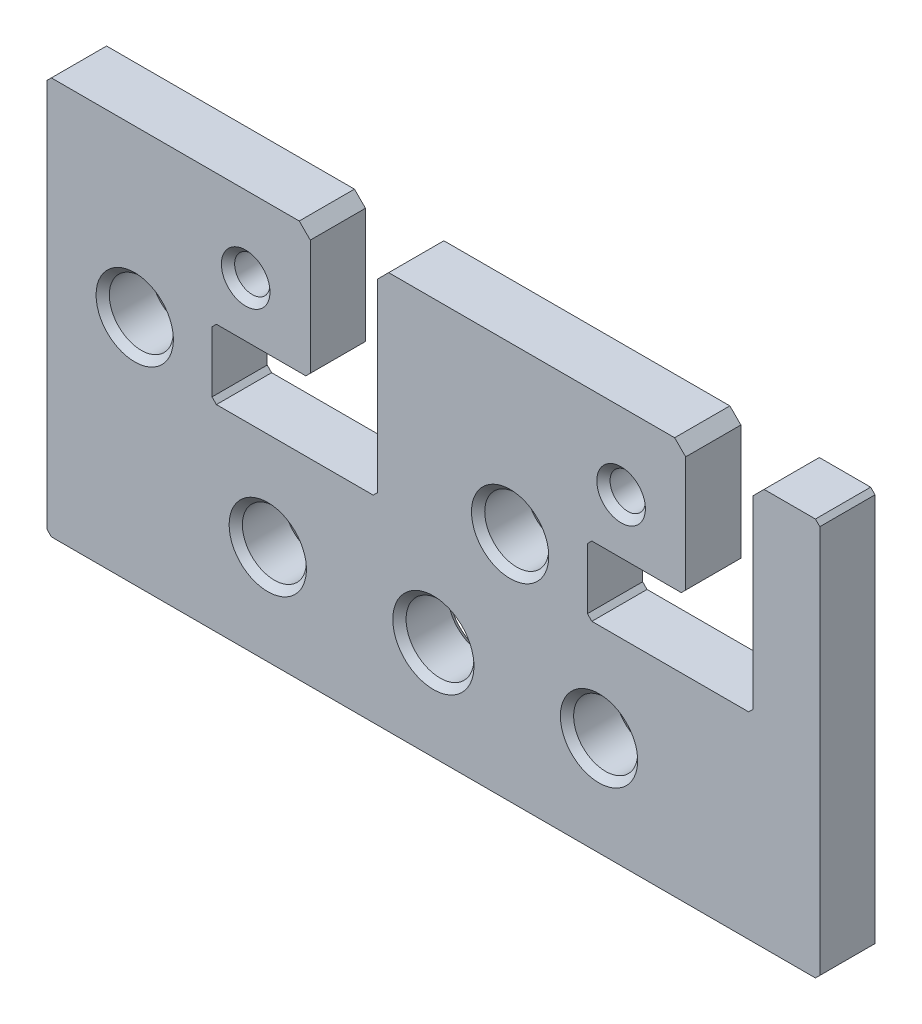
SolidWorks part; units mm, degrees
ref_plane "前基準面" through (0, 0, 0) normal (0, 0, 1) x (1, 0, 0)
ref_plane "上基準面" through (0, 0, 0) normal (0, 1, 0) x (1, 0, 0)
ref_plane "右基準面" through (0, 0, 0) normal (1, 0, 0) x (0, 0, -1)
sketch "草圖1" plane through (0, 0, 0) normal (0, 0, 1) x (1, 0, 0)
  line L0 (-14.0981, -2.6222) -> (55.9019, -2.6222)
  line L1 (55.9019, -2.6222) -> (55.9019, 33.3778)
  line L2 (-14.0981, -2.6222) -> (-14.0981, 33.3778)
  line L3 (-14.0981, 33.3778) -> (9.7519, 33.3778)
  line L4 (9.7519, 33.3778) -> (9.7519, 21.5278)
  line L5 (9.7519, 21.5278) -> (0.8519, 21.5278)
  line L6 (0.8519, 21.5278) -> (0.8519, 15.2278)
  line L7 (0.8519, 15.2278) -> (15.8519, 15.2278)
  line L8 (15.8519, 15.2278) -> (15.8519, 33.3778)
  line L9 (15.8519, 33.3778) -> (43.7519, 33.3778)
  line L10 (43.7519, 33.3778) -> (43.7519, 21.5278)
  line L11 (43.7519, 21.5278) -> (34.8519, 21.5278)
  line L12 (34.8519, 21.5278) -> (34.8519, 15.2278)
  line L13 (34.8519, 15.2278) -> (49.8519, 15.2278)
  line L14 (49.8519, 15.2278) -> (49.8519, 33.3778)
  line L15 (49.8519, 33.3778) -> (55.9019, 33.3778)
  line L16 (-1006.2885, 18.3778) -> (48993.7115, 18.3778) construction
  circle A0 centre (20.9019, 6.3778) radius 3.075
  circle A1 centre (35.9019, 6.3778) radius 2.9
  circle A2 centre (5.9019, 6.3778) radius 2.9
  circle A3 centre (3.9019, 26.4778) radius 1.6
  circle A4 centre (37.9019, 26.4778) radius 1.6
  circle A5 centre (27.8519, 18.3778) radius 2.9
  circle A6 centre (-6.1481, 18.3778) radius 2.9
  point P19 (0.8519, 18.3778)
  point P33 (0, 0)
  point P34 (20.9019, -2.6222)
  dimension "D11" = 6.15
  dimension "D12" = 9
  dimension "D14" = 5.8
  dimension "D15" = 5.8
  dimension "D16" = 15
  dimension "D17" = 15
  dimension "D18" = 3.2
  dimension "D20" = 4.95
  dimension "D21" = 3.05
  dimension "D22" = 3.05
  dimension "D23" = 6.3
  dimension "D24" = 5.8
  dimension "D25" = 5.8
  dimension "D4" = 18
  dimension "D7" = 7
  dimension "D1" = 36
  dimension "D2" = 70
  dimension "D3" = 6.1
  dimension "D5" = 18
  dimension "D6" = 7
  dimension "D8" = 15
  dimension "D9" = 15
extrude "填料-伸長1" add sketch "草圖1" along normal blind 5
chamfer "導角2" distance 0.4 angle 45 6 edges at (43.7519, 21.5278, 2.5) (9.7519, 21.5278, 2.5) (-14.0981, -2.6222, 2.5) (55.9019, -2.6222, 2.5) (55.9019, 33.3778, 2.5) (-14.0981, 33.3778, 2.5)
chamfer "導角3" distance 1 angle 45 4 edges at (49.8519, 33.3778, 2.5) (43.7519, 33.3778, 2.5) (15.8519, 33.3778, 2.5) (9.7519, 33.3778, 2.5)
chamfer "導角5" distance 0.4 angle 45 6 edges at (49.8519, 15.2278, 2.5) (15.8519, 15.2278, 2.5) (34.8519, 15.2278, 2.5) (34.8519, 21.5278, 2.5) (0.8519, 15.2278, 2.5) (0.8519, 21.5278, 2.5)
sketch "草圖2" plane through (0, -2.6222, 0) normal (0, -1, 0) x (1, 0, 0)
  line L0 (-13.6981, 0) -> (55.5019, 0) construction
  line L1 (20.9019, -995) -> (20.9019, 49005) construction
  line L2 (-13.6981, 5) -> (55.5019, 5) construction
  circle A0 centre (-1.6981, 2.5) radius 1.4
  circle A1 centre (43.5019, 2.5) radius 1.4
  point P13 (20.9019, 5)
  dimension "D1" = 2.8
  dimension "D2" = 2.8
  dimension "D4" = 45.2
  dimension "D5" = 22.6
  dimension "D3" = 2.5
extrude "除料-伸長1" cut sketch "草圖2" against normal blind 10
chamfer "導角4" distance 0.6 angle 45 16 edges at (5.5019, 26.4778, 5) (39.5019, 26.4778, 0) (8.8019, 6.3778, 0) (23.9769, 6.3778, 0) (38.8019, 6.3778, 0) (43.5019, -2.6222, 1.1) (-1.6981, -2.6222, 1.1) (8.8019, 6.3778, 5) (38.8019, 6.3778, 5) (23.9769, 6.3778, 5) (39.5019, 26.4778, 5) (5.5019, 26.4778, 0) (30.7519, 18.3778, 0) (30.7519, 18.3778, 5) (-3.2481, 18.3778, 0) (-3.2481, 18.3778, 5)
thread "螺紋2" pitch 1 start angle 0, offset 0, length 2.8, pitch 1, diameter 6
ref_plane "平面3" through (38.9019, 6.4278, 0.6) normal (0, -1, 0) x (1, 0, 0)
sketch "螺紋輪廓3" plane through (38.9019, 6.4278, 0.6) normal (0, -1, 0) x (1, 0, 0)
  line L0 (0, 0) -> (0, 1) construction
  line L11 (0, 0) -> (0, 0.875)
  line L12 (0, 0.875) -> (-0.5413, 0.5625)
  line L13 (-0.5413, 0.5625) -> (-0.5413, 0.3125)
  line L15 (-0.5413, 0.3125) -> (0, 0)
  line L17 (-0.5413, 0.4375) -> (0, 0.4375) construction
  point P2 (0, 0)
  dimension "Pitch" = 1
  dimension "Profile_Angle" = 60
  dimension "Profile_Land" = 0.25
  dimension "Profile_Height" = 0.5413
thread "螺紋3" pitch 1 start angle 0, offset 0, length 2.8, pitch 1, diameter 6
ref_plane "平面4" through (8.9019, 6.4278, 0.6) normal (0, -1, 0) x (1, 0, 0)
sketch "螺紋輪廓4" plane through (8.9019, 6.4278, 0.6) normal (0, -1, 0) x (1, 0, 0)
  line L0 (0, 0) -> (0, 1) construction
  line L11 (0, 0) -> (0, 0.875)
  line L12 (0, 0.875) -> (-0.5413, 0.5625)
  line L13 (-0.5413, 0.5625) -> (-0.5413, 0.3125)
  line L15 (-0.5413, 0.3125) -> (0, 0)
  line L17 (-0.5413, 0.4375) -> (0, 0.4375) construction
  point P2 (0, 0)
  dimension "Pitch" = 1
  dimension "Profile_Angle" = 60
  dimension "Profile_Land" = 0.25
  dimension "Profile_Height" = 0.5413
thread "螺紋4" pitch 0.5 start angle 0, offset 0, length 3.2, pitch 0.5, diameter 3.2
ref_plane "平面5" through (39.6019, 26.5278, 0.6) normal (0, -1, 0) x (1, 0, 0)
sketch "螺紋輪廓5" plane through (39.6019, 26.5278, 0.6) normal (0, -1, 0) x (1, 0, 0)
  line L0 (0, 0) -> (0, 0.5) construction
  line L11 (0, 0) -> (0, 0.4375)
  line L12 (0, 0.4375) -> (-0.2706, 0.2812)
  line L13 (-0.2706, 0.2812) -> (-0.2706, 0.1562)
  line L15 (-0.2706, 0.1562) -> (0, 0)
  line L17 (-0.2706, 0.2187) -> (0, 0.2187) construction
  point P2 (0, 0)
  dimension "Pitch" = 0.5
  dimension "Profile_Angle" = 60
  dimension "Profile_Land" = 0.125
  dimension "Profile_Height" = 0.2706
thread "螺紋5" pitch 0.5 start angle 0, offset 0, length 3.2, pitch 0.5, diameter 3.2
ref_plane "平面6" through (5.6019, 26.5278, 0.6) normal (0, -1, 0) x (1, 0, 0)
sketch "螺紋輪廓6" plane through (5.6019, 26.5278, 0.6) normal (0, -1, 0) x (1, 0, 0)
  line L0 (0, 0) -> (0, 0.5) construction
  line L11 (0, 0) -> (0, 0.4375)
  line L12 (0, 0.4375) -> (-0.2706, 0.2812)
  line L13 (-0.2706, 0.2812) -> (-0.2706, 0.1562)
  line L15 (-0.2706, 0.1562) -> (0, 0)
  line L17 (-0.2706, 0.2187) -> (0, 0.2187) construction
  point P2 (0, 0)
  dimension "Pitch" = 0.5
  dimension "Profile_Angle" = 60
  dimension "Profile_Land" = 0.125
  dimension "Profile_Height" = 0.2706
thread "螺紋6" pitch 0.5 start angle 0, offset 0, length 0, pitch 0.5, diameter 3
ref_plane "平面7" through (45.0019, -1.9722, 2.5) normal (0, 0, 1) x (1, 0, 0)
sketch "螺紋輪廓7" plane through (45.0019, -1.9722, 2.5) normal (0, 0, 1) x (1, 0, 0)
  line L0 (0, 0) -> (0, 0.5) construction
  line L11 (0, 0) -> (0, 0.4375)
  line L12 (0, 0.4375) -> (-0.2706, 0.2812)
  line L13 (-0.2706, 0.2812) -> (-0.2706, 0.1562)
  line L15 (-0.2706, 0.1562) -> (0, 0)
  line L17 (-0.2706, 0.2187) -> (0, 0.2187) construction
  point P2 (0, 0)
  dimension "Pitch" = 0.5
  dimension "Profile_Angle" = 60
  dimension "Profile_Land" = 0.125
  dimension "Profile_Height" = 0.2706
thread "螺紋7" pitch 0.5 start angle 0, offset 0, length 0, pitch 0.5, diameter 3
ref_plane "平面8" through (-0.1981, -1.9722, 2.5) normal (0, 0, 1) x (1, 0, 0)
sketch "螺紋輪廓8" plane through (-0.1981, -1.9722, 2.5) normal (0, 0, 1) x (1, 0, 0)
  line L0 (0, 0) -> (0, 0.5) construction
  line L11 (0, 0) -> (0, 0.4375)
  line L12 (0, 0.4375) -> (-0.2706, 0.2812)
  line L13 (-0.2706, 0.2812) -> (-0.2706, 0.1562)
  line L15 (-0.2706, 0.1562) -> (0, 0)
  line L17 (-0.2706, 0.2187) -> (0, 0.2187) construction
  point P2 (0, 0)
  dimension "Pitch" = 0.5
  dimension "Profile_Angle" = 60
  dimension "Profile_Land" = 0.125
  dimension "Profile_Height" = 0.2706
thread "螺紋8" pitch 1.27 start angle 0, offset 0, length 2.6, pitch 1.27, diameter 6.35
ref_plane "平面9" through (24.0769, 6.4278, 0.6) normal (0, -1, 0) x (1, 0, 0)
sketch "螺紋輪廓9" plane through (24.0769, 6.4278, 0.6) normal (0, -1, 0) x (1, 0, 0)
  line L0 (0, 0) -> (0, 1.27) construction
  line L11 (0, 0) -> (0, 1.1112)
  line L12 (0, 1.1112) -> (-0.6874, 0.7144)
  line L13 (-0.6874, 0.7144) -> (-0.6874, 0.3969)
  line L15 (-0.6874, 0.3969) -> (0, 0)
  line L17 (-0.6874, 0.5556) -> (0, 0.5556) construction
  point P2 (0, 0)
  dimension "Pitch" = 1.27
  dimension "Profile_Angle" = 60
  dimension "Profile_Land" = 0.3175
  dimension "Profile_Height" = 0.6874
thread "螺紋10" pitch 1 start angle 0, offset 0, length 2.8, pitch 1, diameter 6
ref_plane "平面11" through (-3.5981, 18.4278, 0.6) normal (0, -1, 0) x (1, 0, 0)
sketch "螺紋輪廓11" plane through (-3.5981, 18.4278, 0.6) normal (0, -1, 0) x (1, 0, 0)
  line L0 (0, 0) -> (0, 1) construction
  line L11 (0, 0) -> (0, 0.875)
  line L12 (0, 0.875) -> (-0.5413, 0.5625)
  line L13 (-0.5413, 0.5625) -> (-0.5413, 0.3125)
  line L15 (-0.5413, 0.3125) -> (0, 0)
  line L17 (-0.5413, 0.4375) -> (0, 0.4375) construction
  point P2 (0, 0)
  dimension "Pitch" = 1
  dimension "Profile_Angle" = 60
  dimension "Profile_Land" = 0.25
  dimension "Profile_Height" = 0.5413
thread "螺紋11" pitch 1 start angle 0, offset 0, length 2.8, pitch 1, diameter 6
ref_plane "平面12" through (28.4019, 18.4278, 0.6) normal (0, -1, 0) x (1, 0, 0)
sketch "螺紋輪廓12" plane through (28.4019, 18.4278, 0.6) normal (0, -1, 0) x (1, 0, 0)
  line L0 (0, 0) -> (0, 1) construction
  line L11 (0, 0) -> (0, 0.875)
  line L12 (0, 0.875) -> (-0.5413, 0.5625)
  line L13 (-0.5413, 0.5625) -> (-0.5413, 0.3125)
  line L15 (-0.5413, 0.3125) -> (0, 0)
  line L17 (-0.5413, 0.4375) -> (0, 0.4375) construction
  point P2 (0, 0)
  dimension "Pitch" = 1
  dimension "Profile_Angle" = 60
  dimension "Profile_Land" = 0.25
  dimension "Profile_Height" = 0.5413
